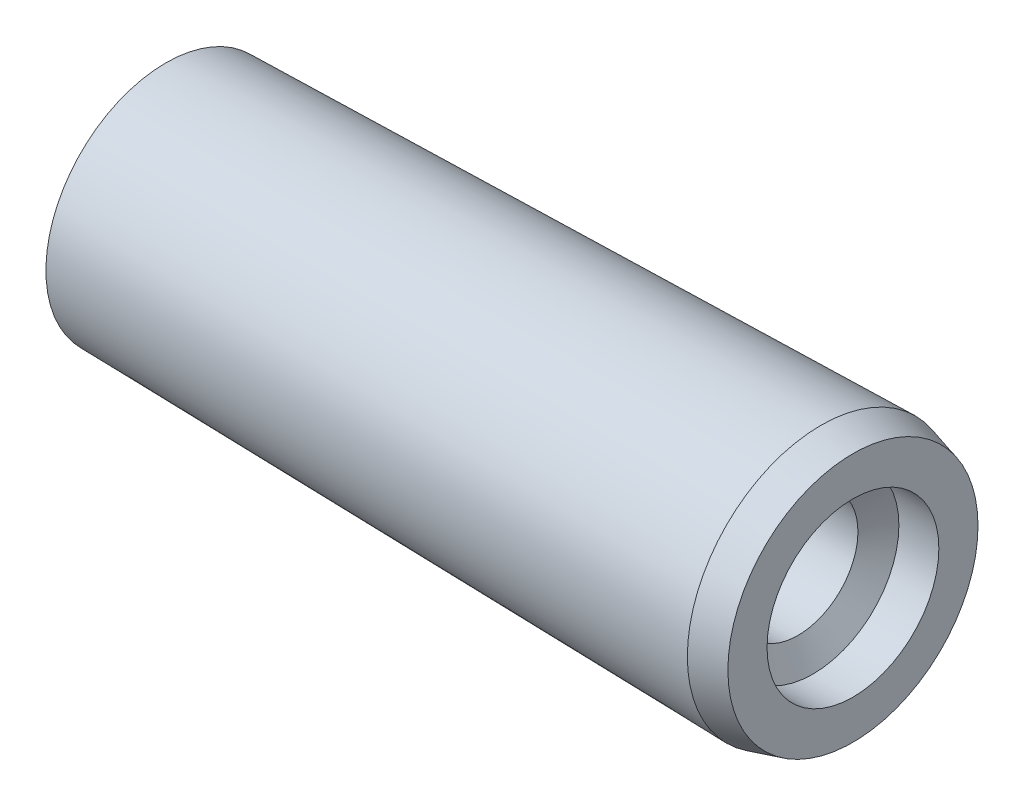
SolidWorks part; units mm, degrees
ref_plane "Front" through (0, 0, 0) normal (0, 0, 1) x (1, 0, 0)
ref_plane "Top" through (0, 0, 0) normal (0, 1, 0) x (1, 0, 0)
ref_plane "Right" through (0, 0, 0) normal (1, 0, 0) x (0, 0, -1)
sketch "Sketch1" plane through (0, 0, 0) normal (0, 0, 1) x (1, 0, 0)
  line L0 (0.8038, 0) -> (0.8038, 3) construction
  line L1 (0, 0) -> (18, 0) construction
  line L2 (18, 0) -> (18, 3.1296)
  line L3 (18, 3.1296) -> (17.2, 3.344)
  line L4 (17.2, 3.344) -> (0.8038, 3)
  line L5 (0.8038, 3) -> (17.2, 3) construction
  line L6 (18, 0) -> (16.0998, 0) construction
  line L7 (18, 0) -> (0, 0)
  line L8 (0, 0) -> (0, -2.2751) construction
  line L9 (17.2, 3) -> (17.2, 3.344) construction
  arc A0 (0.8038, 3) -> (0, 0) centre (6, 0) ccw
  dimension "D1" = 6
  dimension "D2" = 0.344
  dimension "l" = 18
  dimension "d" = 6
  dimension "a" = 0.8
  dimension "D5" = 75
revolve "Body" add sketch "Sketch1" angle 360 about L7
sketch "Sketch2" plane through (0, 0, 0) normal (0, 0, 1) x (1, 0, 0)
  line L0 (18, 0) -> (18, 2.15)
  line L2 (18, 2.15) -> (17, 2.15)
  line L3 (17, 2.15) -> (16.6247, 1.5)
  line L4 (16.6247, 1.5) -> (8, 1.5)
  line L5 (8, 1.5) -> (7.134, 0)
  line L6 (7.134, 0) -> (18, 0)
  line L8 (18, 0) -> (13.9526, 0) construction
  line L9 (18, -3.1296) -> (18, 3.1296) construction
  dimension "t3" = 1
  dimension "D22" = 60
  dimension "d1" = 4.3
  dimension "D4" = 60
  dimension "d0" = 3
  dimension "t1" = 10
revolve "Hole" cut sketch "Sketch2" angle 360 about L8
sketch "Sketch3" plane through (0, 0, 0) normal (0, 0, 1) x (1, 0, 0)
  line L0 (16.0474, 1.5) -> (16.336, 2)
  line L1 (16.336, 2) -> (16.6247, 1.5)
  line L2 (16.6247, 1.5) -> (16.6247, 0.9226)
  line L3 (16.6247, 0.9226) -> (16.0474, 0.9226)
  line L4 (16.0474, 0.9226) -> (16.0474, 1.5)
  line L5 (0, 0) -> (23.9263, 0) construction
  line L6 (16.6247, 1.5) -> (8, 1.5) construction
  dimension "D1" = 4
revolve "Cut-Revolve10" [suppressed] cut sketch "Sketch3" angle 360 about L5
pattern_linear "LPattern10" [suppressed] count 8 spacing 0.75 along (-1, 0, 0)
equation "\"D1@Sketch1\" = \"d@Sketch1\""
equation "\"D2@Sketch1\" =  ( \"l@Sketch1\" - \"a@Sketch1\" )  / 50"
equation "\"D1@Sketch3\" = \"d1@ThreadCosmetic1\""
equation "\"D3@LPattern10\" = (  \"d1@ThreadCosmetic1\" - \"d0@Sketch2\" )  / 2 * 1.5"
equation "\"D1@LPattern10\" = \"t1@ThreadCosmetic1\" / \"D3@LPattern10\""
